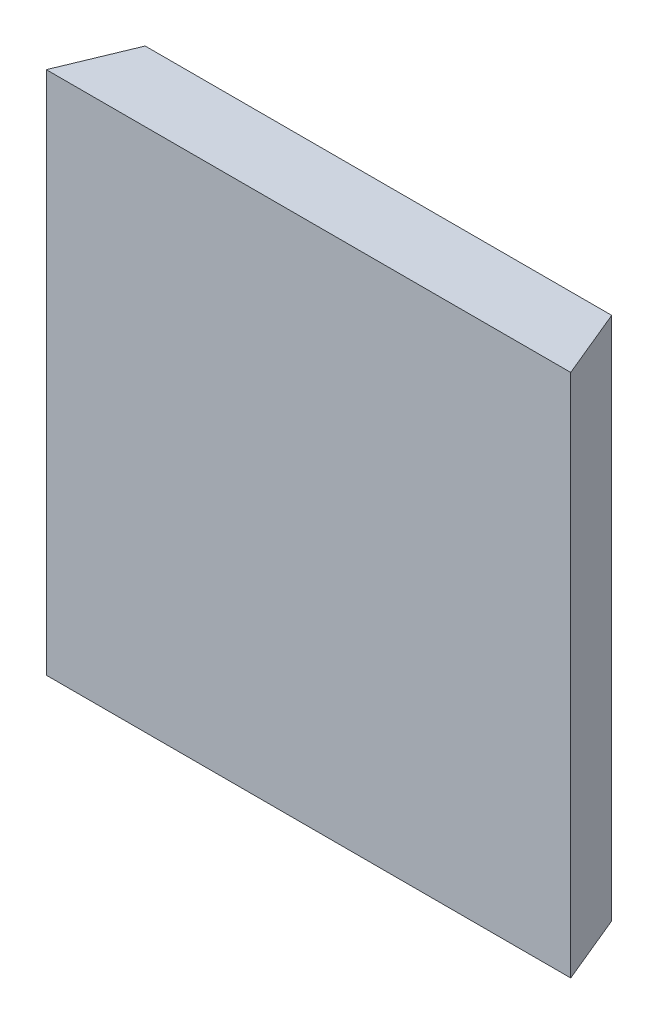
SolidWorks part; units mm, degrees
ref_plane "Ebene vorne" through (0, 0, 0) normal (0, 0, 1) x (1, 0, 0)
ref_plane "Ebene oben" through (0, 0, 0) normal (0, 1, 0) x (1, 0, 0)
ref_plane "Ebene rechts" through (0, 0, 0) normal (1, 0, 0) x (0, 0, -1)
sketch "Skizze1" plane through (0, 0, 0) normal (0, 0, 1) x (1, 0, 0)
  line L0 (-15, 0) -> (15, 0)
  line L1 (15, 0) -> (15, 30)
  line L2 (15, 30) -> (-15, 30)
  line L3 (-15, 30) -> (-15, 0)
  line L4 (0, 30) -> (0, 0) construction
  dimension "D1" = 30
  dimension "D2" = 30
extrude "Aufsatz-Linear austragen1" add sketch "Skizze1" along normal blind 4
chamfer "Fase1" distance 4 angle 22.5 2 edges at (15, 15, 0) (-15, 15, 0)
